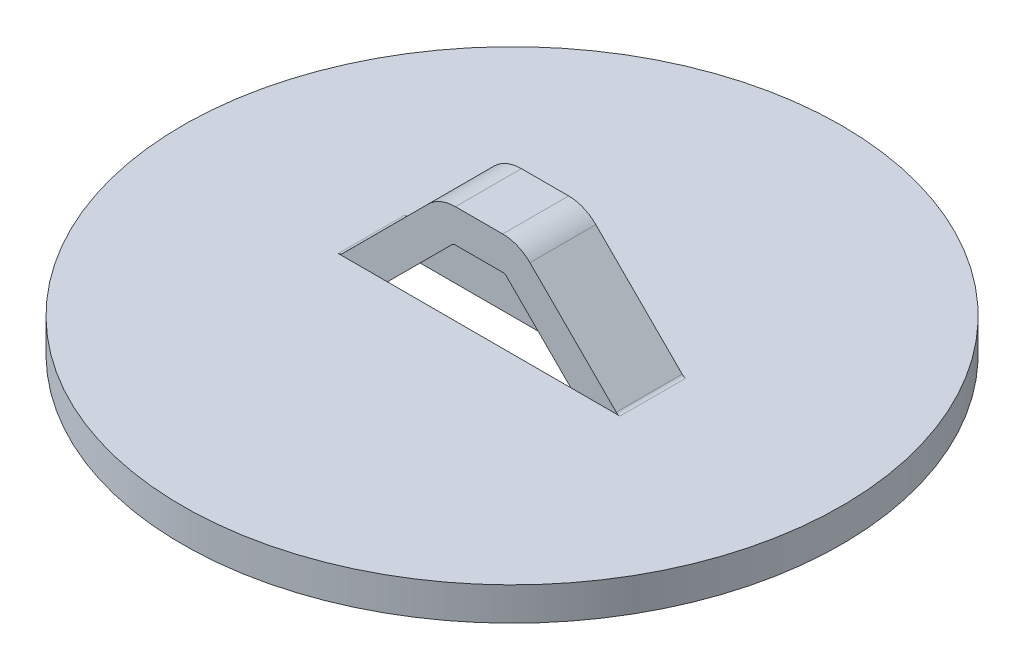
SolidWorks part; units mm, degrees
other "Boss-Extrude1"
ref_plane "Front Plane" through (0, 0, 0) normal (0, 0, 1) x (1, 0, 0)
ref_plane "Top Plane" through (0, 0, 0) normal (0, 1, 0) x (1, 0, 0)
ref_plane "Right Plane" through (0, 0, 0) normal (1, 0, 0) x (0, 0, -1)
imported_body "Imported1"
sketch "Sketch1" plane through (0, -1.6002, 0) normal (0, -1, 0) x (-1, 0, 0)
  line L0 (0, 3.175) -> (0, 0) construction
  line L1 (1.137, 3.175) -> (-1.137, 3.175) construction
  line L2 (6.7854, 3.175) -> (6.7854, 0) construction
  line L3 (6.7854, 3.175) -> (6.7854, 0)
  line L4 (-6.7854, 3.175) -> (-6.7854, 0)
  line L5 (-6.7854, 3.175) -> (6.7854, 3.175)
  line L6 (-6.7854, 0) -> (6.7854, 0)
  circle A0 centre (0, 1.5875) radius 15.875
  dimension "D1" = 31.75
extrude "Boss-Extrude2" add sketch "Sketch1" against normal up to vertex
other "DeleteFace1"
